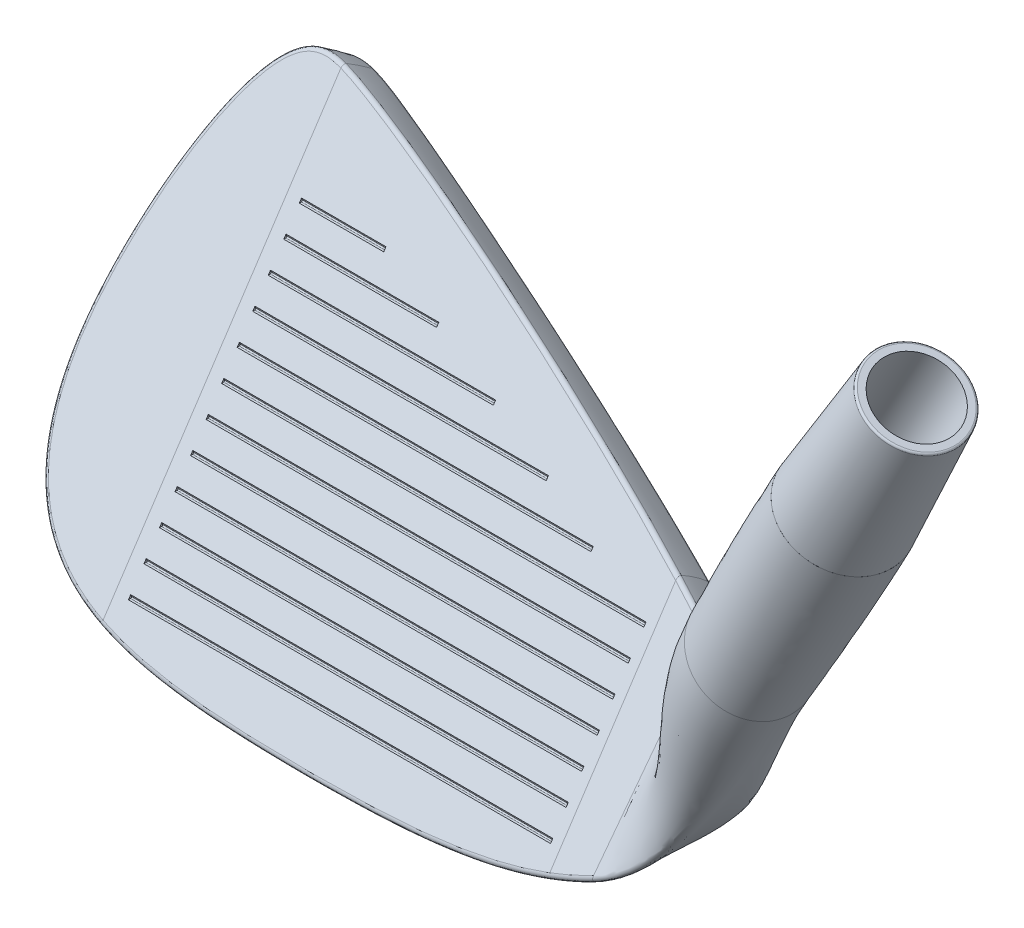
SolidWorks part; units mm, degrees
ref_plane "Front Plane" through (0, 0, 0) normal (0, 0, 1) x (1, 0, 0)
ref_plane "Top Plane" through (0, 0, 0) normal (0, 1, 0) x (1, 0, 0)
ref_plane "Right Plane" through (0, 0, 0) normal (1, 0, 0) x (0, 0, -1)
ref_plane "Plane1" through (0, 0.3886, -8.134) normal (0, 0.0477, -0.9989) x (-1, 0, 0)
sketch "Sketch1" plane through (0, 0.3886, -8.134) normal (0, 0.0477, -0.9989) x (-1, 0, 0)
  line L0 (-42.8771, 50.5257) -> (-36.9568, 53.8715)
  line L1 (-36.9568, 53.8715) -> (-46.7968, 71.2834)
  line L2 (-46.7968, 71.2834) -> (-51.803, 68.4543)
  line L3 (-35.5238, 51.3356) -> (-48.0086, 73.4277) construction
  spline S0 degree 3 poles (-42.8771, 50.5257) (-43.777, 52.3333) (-44.6769, 54.1408) (-45.5768, 55.9483) (-46.4766, 57.7558) (-47.3765, 59.5633) (-48.2764, 61.3708) (-49.4519, 63.732) (-50.6274, 66.0931) (-51.803, 68.4543) knots 0 0 0 0 0.006057 0.006057 0.006057 0.012115 0.012115 0.012115 0.020028 0.020028 0.020028 0.020028
revolve "Revolve1" add sketch "Sketch1" angle 360 about L3
hole_wizard "Ø9.4 (9.4) Diameter Hole1" positions "Sketch3" profile "Sketch2" hole size "Ø9.4" standard "ANSI Metric"
sketch "Sketch3" plane through (32.0207, 56.5965, 2.7039) normal (-0.492, -0.8696, -0.0415) x (-0.8706, 0.4914, 0.0235)
  point P0 (-5.67, 8.1423)
sketch "Sketch2" plane through (36.9571, 54.1985, -5.5622) normal (0.6487, -0.398, 0.6487) x (0.5806, -0.2922, -0.7599)
  line L0 (0, 0) -> (0, 25.5459)
  line L1 (0, 25.5459) -> (4.7, 25.5459)
  line L2 (4.7, 25.5459) -> (4.7, 0)
  line L5 (4.7, 0) -> (0, 0)
  line L11 (0, -6.35) -> (0, 107.95) construction
  dimension "Thru Hole Dia." = 9.4
  dimension "Thru Hole Depth" = 25.5459
fillet "Fillet1" radius 0.25 1 edges at (41.792, 74.4224, -4.7324)
imported_body "Imported3"
